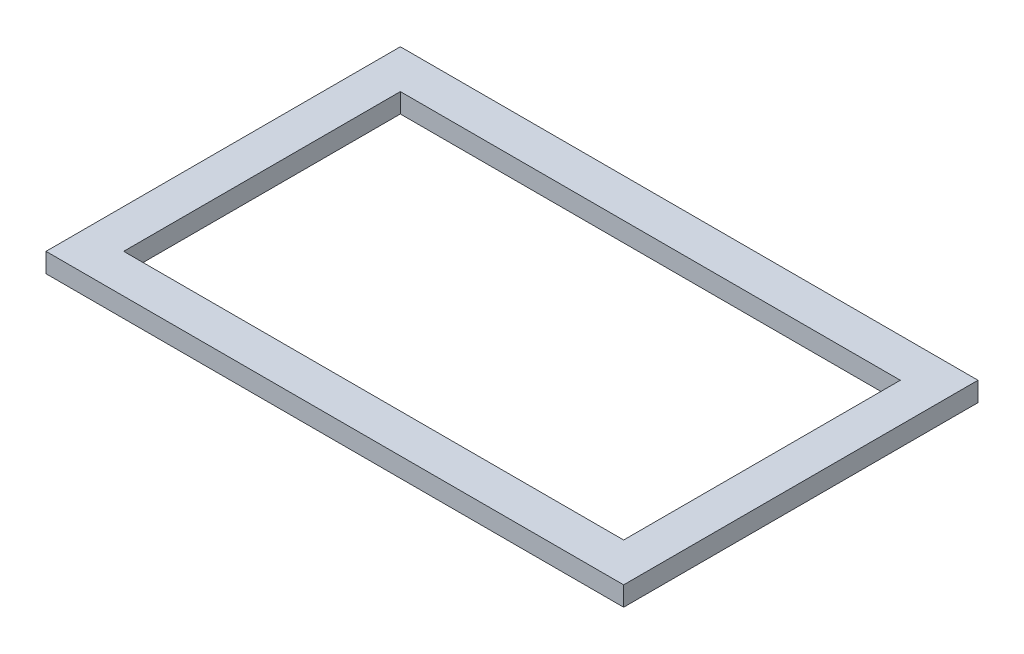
SolidWorks part; units mm, degrees
ref_plane "Front Plane" through (0, 0, 0) normal (0, 0, 1) x (1, 0, 0)
ref_plane "Top Plane" through (0, 0, 0) normal (0, 1, 0) x (1, 0, 0)
ref_plane "Right Plane" through (0, 0, 0) normal (1, 0, 0) x (0, 0, -1)
sketch "Sketch1" plane through (0, 0, 0) normal (0, 1, 0) x (1, 0, 0)
  line L1 (-59.5, -36.5) -> (59.5, -36.5)
  line L2 (-59.5, -36.5) -> (-59.5, 36.5)
  line L3 (-59.5, 36.5) -> (59.5, 36.5)
  line L4 (59.5, -36.5) -> (59.5, 36.5)
  line L5 (-59.5, -36.5) -> (59.5, 36.5) construction
  line L6 (-59.5, 36.5) -> (59.5, -36.5) construction
  line L7 (-51.5, -28.5) -> (51.5, -28.5)
  line L8 (-51.5, -28.5) -> (-51.5, 28.5)
  line L9 (-51.5, 28.5) -> (51.5, 28.5)
  line L10 (51.5, -28.5) -> (51.5, 28.5)
  line L11 (-51.5, -28.5) -> (51.5, 28.5) construction
  line L12 (-51.5, 28.5) -> (51.5, -28.5) construction
  point P0 (0, 0)
  point P6 (0, 0)
  dimension "D1" = 119
  dimension "D2" = 73
  dimension "D3" = 103
  dimension "D4" = 57
extrude "Extrude1" add sketch "Sketch1" along normal blind 4
